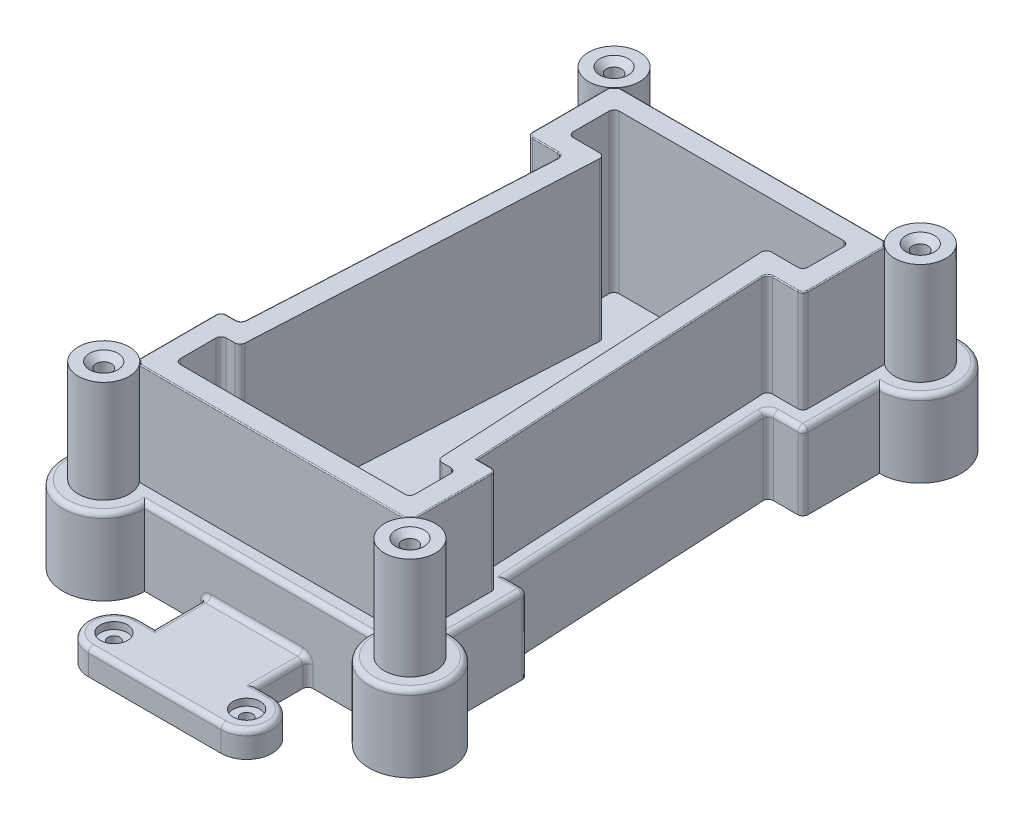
SolidWorks part; units mm, degrees
ref_plane "Front Plane" through (0, 0, 0) normal (0, 0, 1) x (1, 0, 0)
ref_plane "Top Plane" through (0, 0, 0) normal (0, 1, 0) x (1, 0, 0)
ref_plane "Right Plane" through (0, 0, 0) normal (1, 0, 0) x (0, 0, -1)
sketch "Sketch1" plane through (0, 0, 0) normal (0, 1, 0) x (1, 0, 0)
  line L0 (0, -63.5) -> (0, 63.5) construction
  line L1 (27.94, 63.5) -> (-27.94, 63.5)
  line L2 (-38.1, 53.34) -> (-38.1, 34.29)
  line L4 (-38.1, 34.29) -> (-29.4259, 34.29)
  line L5 (-38.1, 85.1067) -> (-38.1, 53.34) construction
  line L6 (-33.02, 0) -> (33.02, 0) construction
  line L7 (-38.1, -85.1067) -> (-38.1, -53.34) construction
  line L8 (-38.1, -34.29) -> (-33.02, -34.29)
  line L9 (-38.1, -53.34) -> (-38.1, -34.29)
  line L10 (27.94, -63.5) -> (-27.94, -63.5)
  line L11 (38.1, -85.1067) -> (38.1, -53.34) construction
  line L12 (38.1, 85.1067) -> (38.1, 53.34) construction
  line L13 (38.1, -53.34) -> (38.1, -34.29)
  line L14 (38.1, -34.29) -> (33.02, -34.29)
  line L15 (33.02, -34.29) -> (29.4259, 34.29)
  line L16 (38.1, 34.29) -> (29.4259, 34.29)
  line L17 (38.1, 53.34) -> (38.1, 34.29)
  line L18 (-33.02, -34.29) -> (-29.4259, 34.29)
  arc A0 (-27.94, 63.5) -> (-38.1, 53.34) centre (-38.1, 63.5) ccw
  arc A1 (-27.94, -63.5) -> (-38.1, -53.34) centre (-38.1, -63.5) cw
  arc A2 (27.94, -63.5) -> (38.1, -53.34) centre (38.1, -63.5) ccw
  arc A3 (27.94, 63.5) -> (38.1, 53.34) centre (38.1, 63.5) cw
  point P20 (0, 0)
  dimension "D2" = 10.16
  dimension "D1" = 127
  dimension "D3" = 38.1
  dimension "D4" = 19.05
  dimension "D5" = 87
  dimension "D6" = 93
  dimension "D7" = 68.58
  dimension "D8" = 8.6741
extrude "A1" add sketch "Sketch1" along normal blind 19.05
sketch "Sketch2" plane through (0, 0, 0) normal (0, -1, 0) x (1, 0, 0)
  line L1 (-12.7, 63.5) -> (-12.7, 76.2)
  line L2 (-27.94, 63.5) -> (27.94, 63.5) construction
  line L3 (-12.7, 76.2) -> (-16.51, 76.2)
  line L4 (-16.51, 88.9) -> (16.51, 88.9)
  line L5 (0, 0) -> (0, 123.1625) construction
  line L6 (-12.7, 63.5) -> (12.7, 63.5)
  line L7 (12.7, 76.2) -> (16.51, 76.2)
  line L8 (12.7, 63.5) -> (12.7, 76.2)
  arc A0 (-16.51, 76.2) -> (-16.51, 88.9) centre (-16.51, 82.55) cw
  arc A1 (16.51, 76.2) -> (16.51, 88.9) centre (16.51, 82.55) ccw
  point P14 (0, 88.9)
  dimension "D2" = 6.35
  dimension "D1" = 12.7
  dimension "D3" = 16.51
  dimension "D4" = 25.4
extrude "A2" add sketch "Sketch2" against normal blind 6.35
sketch "Sketch3" plane through (0, 19.05, 0) normal (0, 1, 0) x (1, 0, 0)
  line L24 (-34.29, 38.1) -> (-25.411, 38.1)
  line L25 (-34.29, 38.1) -> (-25.411, 38.1)
  line L26 (-25.411, 38.1) -> (-29.4044, -38.1)
  line L27 (-25.411, 38.1) -> (-29.4044, -38.1)
  line L30 (29.4044, -38.1) -> (25.411, 38.1)
  line L31 (29.4044, -38.1) -> (25.411, 38.1)
  line L36 (-34.29, 58.42) -> (-34.29, 38.1)
  line L39 (-29.4044, -38.1) -> (-34.29, -38.1)
  line L40 (-34.29, -38.1) -> (-34.29, -58.42)
  line L41 (-33.02, -59.69) -> (33.02, -59.69)
  line L42 (34.29, -58.42) -> (34.29, -38.1)
  line L43 (34.29, -38.1) -> (29.4044, -38.1)
  line L45 (25.411, 38.1) -> (34.29, 38.1)
  line L46 (34.29, 38.1) -> (34.29, 58.42)
  line L47 (33.02, 59.69) -> (-33.02, 59.69)
  line L48 (-34.29, 58.42) -> (-34.29, 38.1)
  line L51 (-29.4044, -38.1) -> (-34.29, -38.1)
  line L52 (-34.29, -38.1) -> (-34.29, -58.42)
  line L53 (-33.02, -59.69) -> (33.02, -59.69)
  line L54 (34.29, -58.42) -> (34.29, -38.1)
  line L55 (34.29, -38.1) -> (29.4044, -38.1)
  line L57 (25.411, 38.1) -> (34.29, 38.1)
  line L58 (34.29, 38.1) -> (34.29, 58.42)
  line L59 (33.02, 59.69) -> (-33.02, 59.69)
  arc A0 (-34.29, 58.42) -> (-33.02, 59.69) centre (-38.1, 63.5) ccw
  arc A1 (33.02, 59.69) -> (34.29, 58.42) centre (38.1, 63.5) ccw
  arc A2 (34.29, -58.42) -> (33.02, -59.69) centre (38.1, -63.5) ccw
  arc A3 (-33.02, -59.69) -> (-34.29, -58.42) centre (-38.1, -63.5) ccw
  arc A12 (-33.02, 59.69) -> (-34.29, 58.42) centre (-38.1, 63.5) ccw
  arc A13 (-34.29, -58.42) -> (-33.02, -59.69) centre (-38.1, -63.5) ccw
  arc A14 (33.02, -59.69) -> (34.29, -58.42) centre (38.1, -63.5) ccw
  arc A15 (34.29, 58.42) -> (33.02, 59.69) centre (38.1, 63.5) ccw
  dimension "D1" = 3.81
extrude "A3" add sketch "Sketch3" along normal blind 25.4
sketch "Sketch10" plane through (0, 19.05, 0) normal (0, 1, 0) x (1, 0, 0)
  circle A0 centre (-38.1, 63.5) radius 6.35
  arc A1 (-27.94, 63.5) -> (-38.1, 53.34) centre (-38.1, 63.5) ccw construction
  circle A2 centre (38.1, 63.5) radius 6.35
  circle A3 centre (38.1, -63.5) radius 6.35
  circle A4 centre (-38.1, -63.5) radius 6.35
  dimension "D1" = 3.81
extrude "A4" add sketch "Sketch10" along normal up to surface (25.4 mm away) separate body
shell "B1" thickness 5.08
sketch "Sketch4" plane through (0, 13.97, 0) normal (0, -1, 0) x (1, 0, 0)
  line L0 (-20.0578, -43.18) -> (-24.5837, 43.18) construction
  line L1 (-20.0578, -43.18) -> (-24.5837, 43.18)
  line L2 (-29.21, -43.18) -> (-20.0578, -43.18) construction
  line L3 (-29.21, -43.18) -> (-20.0578, -43.18)
  line L4 (24.5837, 43.18) -> (20.0578, -43.18) construction
  line L5 (24.5837, 43.18) -> (20.0578, -43.18)
  line L12 (33.02, -58.42) -> (33.02, -39.37)
  line L13 (33.02, -39.37) -> (24.0727, -39.37)
  line L14 (-28.1993, 39.37) -> (-24.0727, -39.37)
  line L15 (28.1993, 39.37) -> (33.02, 39.37)
  line L16 (33.02, 39.37) -> (33.02, 58.42)
  line L17 (33.02, 58.42) -> (-33.02, 58.42)
  line L18 (-33.02, 58.42) -> (-33.02, 39.37)
  line L19 (-33.02, 39.37) -> (-28.1993, 39.37)
  line L20 (-28.1993, 39.37) -> (-24.0727, -39.37)
  line L21 (-24.0727, -39.37) -> (-33.02, -39.37)
  line L22 (-33.02, -39.37) -> (-33.02, -58.42)
  line L23 (-33.02, -58.42) -> (33.02, -58.42)
  line L24 (33.02, -58.42) -> (33.02, -39.37)
  line L25 (33.02, -39.37) -> (24.0727, -39.37)
  line L26 (24.0727, -39.37) -> (28.1993, 39.37)
  line L27 (28.1993, 39.37) -> (33.02, 39.37)
  line L28 (33.02, 39.37) -> (33.02, 58.42)
  line L29 (33.02, 58.42) -> (-33.02, 58.42)
  line L30 (-33.02, 58.42) -> (-33.02, 39.37)
  line L31 (-33.02, 39.37) -> (-28.1993, 39.37)
  line L32 (24.0727, -39.37) -> (28.1993, 39.37)
  line L33 (-24.0727, -39.37) -> (-33.02, -39.37)
  line L34 (-33.02, -39.37) -> (-33.02, -58.42)
  line L35 (-33.02, -58.42) -> (33.02, -58.42)
  line L40 (-29.21, -54.61) -> (-29.21, -43.18) construction
  line L41 (-29.21, -54.61) -> (-29.21, -43.18)
  line L42 (-24.5837, 43.18) -> (-29.21, 43.18) construction
  line L43 (-29.21, 43.18) -> (-29.21, 54.61) construction
  line L44 (-29.21, 54.61) -> (29.21, 54.61) construction
  line L45 (29.21, 54.61) -> (29.21, 43.18) construction
  line L46 (29.21, 43.18) -> (24.5837, 43.18) construction
  line L48 (20.0578, -43.18) -> (29.21, -43.18) construction
  line L49 (29.21, -43.18) -> (29.21, -54.61) construction
  line L50 (29.21, -54.61) -> (-29.21, -54.61) construction
  line L51 (-29.21, -54.61) -> (-29.21, -43.18)
  line L54 (-24.5837, 43.18) -> (-29.21, 43.18)
  line L55 (-29.21, 43.18) -> (-29.21, 54.61)
  line L56 (-29.21, 54.61) -> (29.21, 54.61)
  line L57 (29.21, 54.61) -> (29.21, 43.18)
  line L58 (29.21, 43.18) -> (24.5837, 43.18)
  line L60 (20.0578, -43.18) -> (29.21, -43.18)
  line L61 (29.21, -43.18) -> (29.21, -54.61)
  line L62 (29.21, -54.61) -> (-29.21, -54.61)
  dimension "D1" = 0
extrude "A5" add sketch "Sketch4" along normal up to surface (8.89 mm away)
hole_wizard "C1" positions "Sketch6" profile "Sketch5" countersink size "#6" standard "ANSI Inch"
sketch "Sketch6" plane through (0, 44.45, 0) normal (0, 1, 0) x (-1, 0, 0)
  point P28 (38.1, 63.5)
  point P31 (-38.1, 63.5)
  point P34 (-38.1, -63.5)
  point P37 (38.1, -63.5)
sketch "Sketch5" plane through (-38.1, 44.45, 63.5) normal (1, 0, 0) x (0, 0, 1)
  line L0 (0, 0) -> (0, 44.45)
  line L1 (0, 44.45) -> (1.8986, 44.45)
  line L2 (1.8986, 44.45) -> (1.8986, 1.38)
  line L3 (1.8986, 1.38) -> (3.5433, 0)
  line L5 (3.5433, 0) -> (0, 0)
  line L6 (-1.8986, 1.38) -> (-3.5433, 0) construction
  line L11 (0, -6.35) -> (0, 107.95) construction
  dimension "Thru Hole Dia." = 3.7973
  dimension "Thru Hole Depth" = 44.45
  dimension "Near C'Sink Dia." = 7.0866
  dimension "Near C'Sink Angle" = 100
hole_wizard "C2" positions "Sketch8" profile "Sketch7" counterbore size "#4" standard "Ansi Inch"
sketch "Sketch8" plane through (0, 6.35, 0) normal (0, 1, 0) x (-1, 0, 0)
  arc A0 (16.51, 76.2) -> (16.51, 88.9) centre (16.51, 82.55) ccw construction
  arc A1 (-16.51, 88.9) -> (-16.51, 76.2) centre (-16.51, 82.55) ccw construction
  point P0 (16.51, 82.55)
  point P1 (-16.51, 82.55)
sketch "Sketch7" plane through (-16.51, 6.35, 82.55) normal (1, 0, 0) x (0, 0, 1)
  line L0 (0, 0) -> (0, 6.35)
  line L1 (0, 6.35) -> (1.4732, 6.35)
  line L3 (1.4732, 6.35) -> (1.4732, 1.7272)
  line L4 (1.4732, 1.7272) -> (3.3731, 1.7272)
  line L5 (3.3731, 1.7272) -> (3.3731, 0)
  line L7 (3.3731, 0) -> (0, 0)
  line L11 (0, -6.35) -> (0, 107.95) construction
  dimension "Thru Hole Dia." = 2.9464
  dimension "Thru Hole Depth" = 6.35
  dimension "C'Bore Dia." = 6.7462
  dimension "C'Bore Depth" = 1.7272
fillet "D1" radius 1.27 12 edges at (20.0578, 24.765, -43.18) (29.21, 24.765, -43.18) (29.21, 24.765, -54.61) (-29.21, 24.765, -54.61) (-29.21, 24.765, -43.18) (-20.0578, 24.765, -43.18) (-24.5837, 24.765, 43.18) (-29.21, 24.765, 43.18) (-29.21, 24.765, 54.61) (29.21, 24.765, 54.61) (29.21, 24.765, 43.18) (24.5837, 24.765, 43.18)
fillet "D2" radius 1.27 14 edges at (-38.1, 9.525, 34.29) (-34.29, 31.75, 38.1) (34.29, 31.75, 38.1) (38.1, 9.525, 34.29) (38.1, 9.525, -34.29) (34.29, 31.75, -38.1) (29.4259, 9.525, -34.29) (25.411, 31.75, -38.1) (-29.4259, 9.525, -34.29) (-25.411, 31.75, -38.1) (-34.29, 31.75, -38.1) (-38.1, 9.525, -34.29) (-29.4044, 31.75, 38.1) (-33.02, 9.525, 34.29)
fillet "D3" radius 1.27 33 edges at (-12.7, 3.175, 63.5) (12.7, 3.175, 63.5) (-38.1, 19.05, -44.45) (-35.5276, 19.05, 34.29) (-37.728, 19.05, 34.662) (38.1, 19.05, -44.45) (37.728, 19.05, -34.662) (34.925, 19.05, 34.29) (37.728, 19.05, 34.662) (14.605, 6.35, 76.2) (22.86, 6.35, 82.55) (-14.605, 6.35, 76.2) (-22.86, 6.35, 82.55) (0, 19.05, -63.5) (-45.2842, 19.05, -70.6842) (-38.1, 19.05, 44.45) (-45.2842, 19.05, 70.6842) (45.2842, 19.05, -70.6842) (33.7971, 19.05, -34.29) (38.1, 19.05, 44.45) (45.2842, 19.05, 70.6842) (0, 19.05, 63.5) (0, 6.35, 63.5) (-12.7, 6.35, 69.85) (12.7, 6.35, 69.85) (0, 6.35, 88.9) (31.258, 19.05, 0.6682) (-37.728, 19.05, -34.662) (-33.7971, 19.05, -34.29) (-29.8429, 19.05, -33.8942) (-31.2264, 19.05, 0.0665) (-33.351, 19.05, 33.9412) (29.8429, 19.05, -33.8942)
fillet "D4" radius 0.254 23 edges at (0, 44.45, -59.69) (34.29, 44.45, -48.895) (33.918, 44.45, -38.472) (29.8846, 44.45, -38.1) (31.2122, 44.45, 38.1) (33.918, 44.45, 38.472) (34.29, 44.45, 48.895) (0, 44.45, 59.69) (-34.29, 44.45, 48.895) (-33.918, 44.45, 38.472) (-31.8148, 44.45, 38.1) (-34.29, 44.45, -48.895) (27.4427, 44.45, 0.6682) (-27.4112, 44.45, 0.0665) (-29.8846, 44.45, -38.1) (25.828, 44.45, -37.7042) (-29.7354, 44.45, 37.7512) (-25.828, 44.45, -37.7042) (-33.918, 44.45, -38.472) (-33.6099, 44.45, -59.0099) (33.6099, 44.45, -59.0099) (33.6099, 44.45, 59.0099) (-33.6099, 44.45, 59.0099)
